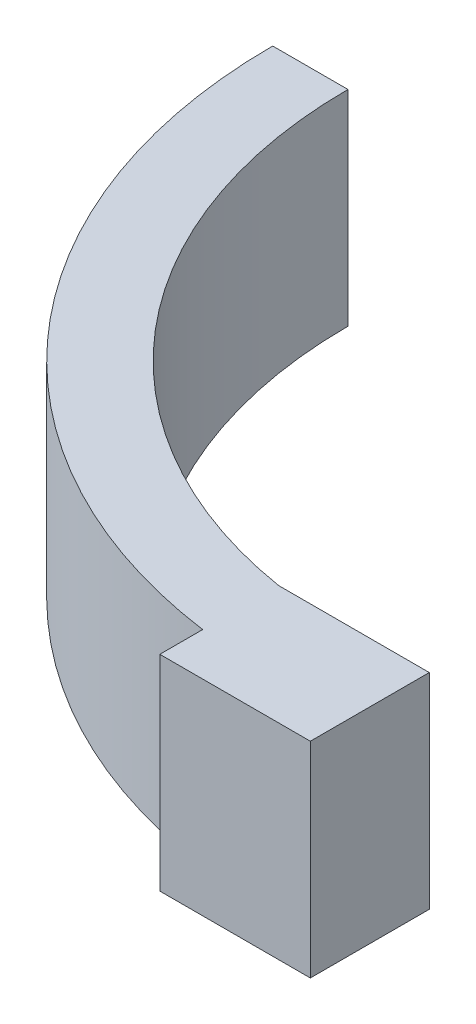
SolidWorks part; units mm, degrees
ref_plane "Front Plane" through (0, 0, 0) normal (0, 0, 1) x (1, 0, 0)
ref_plane "Top Plane" through (0, 0, 0) normal (0, 1, 0) x (1, 0, 0)
ref_plane "Right Plane" through (0, 0, 0) normal (1, 0, 0) x (0, 0, -1)
sketch "Sketch2" plane through (0, 0, 0) normal (0, 1, 0) x (1, 0, 0)
  line L0 (0, 0) -> (0, 250) construction
  line L1 (0, 250) -> (0, 280) construction
  line L4 (0, 250) -> (0, 270) construction
  line L7 (20, 280) -> (-20, 280)
  line L8 (-20, 268.6141) -> (-20, 280) construction
  line L9 (0, 125) -> (174.1964, 125) construction
  line L10 (174.1964, 125) -> (-150.7453, 125) construction
  line L11 (0, 0) -> (0, -20) construction
  line L12 (0, 0) -> (0, -30) construction
  line L13 (-20, -18.6141) -> (-20, -30)
  line L14 (20, -30) -> (-20, -30)
  line L15 (20, 0) -> (20, -30)
  line L17 (-20, 248.3896) -> (20, 248.3896)
  line L19 (-20, 1.6104) -> (20, 1.6104)
  line L20 (20, 1.6104) -> (20, 0)
  line L21 (-20, 280) -> (-20, 268.6141)
  line L22 (20, 248.3896) -> (20, 280)
  arc A0 (-20, 248.3896) -> (-20, 1.6104) centre (0, 125) ccw
  arc A1 (-20, 268.6141) -> (-20, -18.6141) centre (0, 125) ccw
  dimension "D8" = 145
  dimension "D13" = 125
  dimension "D1" = 250
  dimension "D2" = 30
  dimension "D4" = 20
  dimension "D5" = 20
  dimension "D6" = 11.3859
  dimension "D7" = 11.3859
  dimension "D9" = 31.6104
  dimension "D10" = 40
  dimension "D11" = 40
  dimension "D12" = 31.6104
extrude "Boss-Extrude2" add sketch "Sketch2" along normal blind 54.5
sketch "Sketch3" plane through (0, 54.5, 0) normal (0, 1, 0) x (1, 0, 0)
  line L0 (-145, 125) -> (58.1087, 125)
  line L1 (58.1087, 125) -> (58.1087, 296.3735)
  line L2 (58.1087, 296.3735) -> (-145, 296.3735)
  line L3 (-145, 296.3735) -> (-145, 125)
  arc A0 (-20, 268.6141) -> (-20, -18.6141) centre (0, 125) ccw construction
extrude "Cut-Extrude1" cut sketch "Sketch3" against normal through all both and the other way through all
sketch "Sketch4" plane through (0, 0, -125) normal (0, 0, -1) x (-1, 0, 0)
  line L0 (125, 27.25) -> (145, 27.25) construction
  line L1 (125, 0) -> (125, 54.5) construction
  line L2 (145, 0) -> (145, 54.5) construction
  line L3 (125, 27.25) -> (127.5, 27.25)
  line L4 (127.5, 27.25) -> (127.5, 35.25)
  line L5 (127.5, 35.25) -> (142.5, 35.25)
  line L6 (145, 35.25) -> (142.5, 35.25)
  line L7 (127.5, 27.25) -> (127.5, 19.25)
  line L9 (127.5, 19.25) -> (142.5, 19.25)
  line L10 (127.5, 19.25) -> (127.5, 35.25)
  line L11 (127.5, 35.25) -> (142.5, 35.25)
  line L12 (142.5, 19.25) -> (142.5, 35.25)
  dimension "D1" = 2.5
  dimension "D2" = 2.5
  dimension "D3" = 8
  dimension "D4" = 8
extrude "Cut-Extrude2" cut sketch "Sketch4" against normal blind 10 contours L0 L7 L9 L12 | L4 L0 L12 L5
